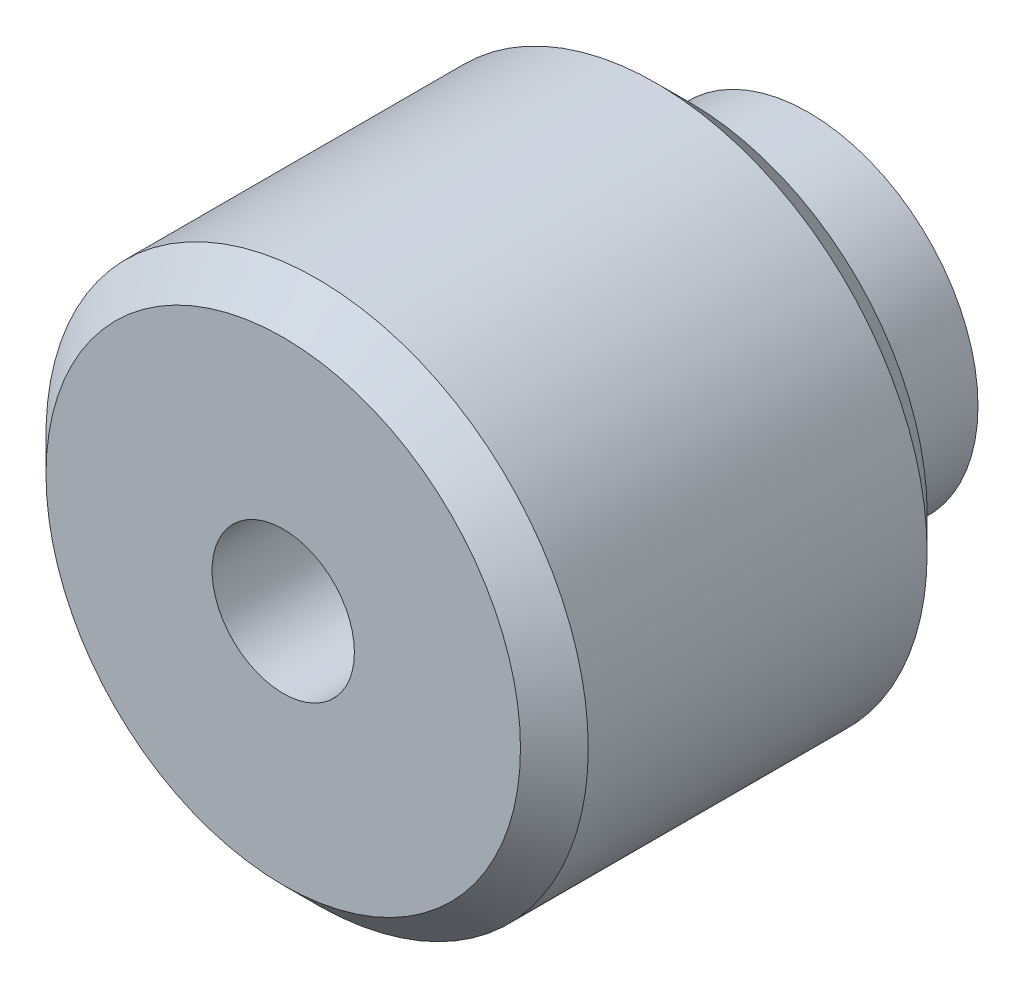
SolidWorks part; units mm, degrees
ref_plane "Front Plane" through (0, 0, 0) normal (0, 0, 1) x (1, 0, 0)
ref_plane "Top Plane" through (0, 0, 0) normal (0, 1, 0) x (1, 0, 0)
ref_plane "Right Plane" through (0, 0, 0) normal (1, 0, 0) x (0, 0, -1)
sketch "Sketch1" plane through (0, 0, 0) normal (0, 0, 1) x (1, 0, 0)
  circle A0 centre (0, 0) radius 8
  dimension "D1" = 16
extrude "Extrude1" add sketch "Sketch1" along normal blind 12
sketch "Sketch2" plane through (0, 0, 0) normal (0, 0, -1) x (-1, 0, 0)
  circle A0 centre (0, 0) radius 5
  dimension "D1" = 10
extrude "Extrude2" add sketch "Sketch2" along normal blind 3.5
chamfer "Chamfer1" distance 1 angle 45 2 edges at (8, 0, 12) (8, 0, 0)
hole_wizard "M5 Tapped Hole1" positions "3DSketch1" profile "Sketch3" tap size "M5" standard "ISO"
sketch3d "3DSketch1"
  line L0 (0, 0, 11) -> (0, 0, 12) construction
  point P0 (0, 0, 12)
sketch "Sketch3" plane through (0, 0, 12) normal (1, 0, 0) x (0, -1, 0)
  line L0 (0, 0) -> (0, 15.5)
  line L1 (0, 15.5) -> (2.1, 15.5)
  line L2 (2.1, 15.5) -> (2.1, 0)
  line L5 (2.1, 0) -> (0, 0)
  line L11 (0, -6.35) -> (0, 107.95) construction
  dimension "Thru Tap Drill Dia." = 4.2
  dimension "Thru Tap Drill Depth" = 15.5
